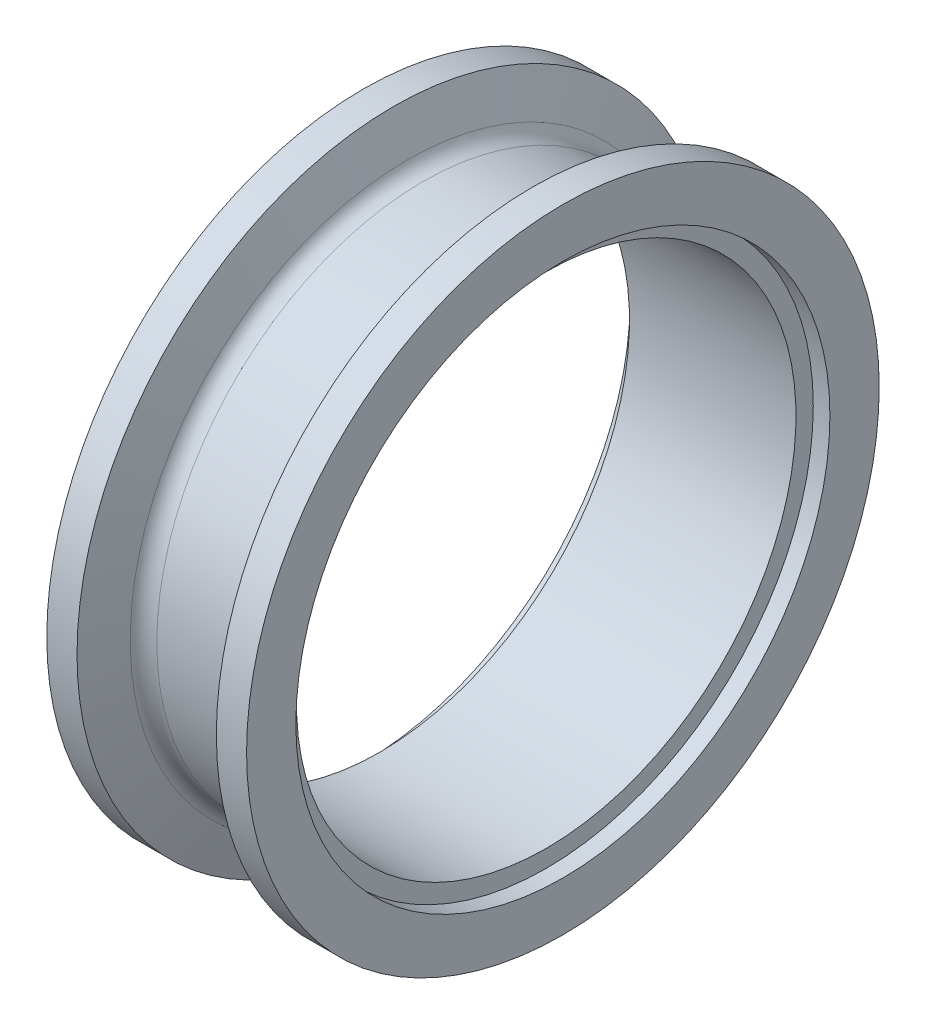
SolidWorks part; units mm, degrees
ref_plane "Front" through (0, 0, 0) normal (0, 0, 1) x (1, 0, 0)
ref_plane "Top" through (0, 0, 0) normal (0, 1, 0) x (1, 0, 0)
ref_plane "Right" through (0, 0, 0) normal (1, 0, 0) x (0, 0, -1)
sketch "Sketch1" plane through (0, 0, 0) normal (0, 0, 1) x (1, 0, 0)
  line L0 (19.05, 0) -> (0, 0) construction
  line L1 (0, 60.325) -> (0, -60.325) construction
  line L2 (0, 60.325) -> (5.7658, 60.325)
  line L3 (5.7658, 60.325) -> (8.4723, 52.8891)
  line L4 (3.175, 47.625) -> (34.925, 47.625)
  line L5 (11.4558, 50.8) -> (26.6442, 50.8)
  line L6 (3.175, 50.927) -> (0, 50.927)
  line L7 (19.05, 55.8345) -> (19.05, 31.4646) construction
  line L8 (34.925, 50.927) -> (34.925, 47.625)
  line L10 (38.1, 60.325) -> (38.1, 50.927)
  line L11 (34.925, 50.927) -> (38.1, 50.927)
  line L12 (0, 60.325) -> (0, 50.927)
  line L13 (32.3342, 60.325) -> (29.6277, 52.8891)
  line L14 (38.1, 60.325) -> (32.3342, 60.325)
  line L15 (3.175, 50.927) -> (3.175, 47.625)
  arc A0 (8.4723, 52.8891) -> (11.4558, 50.8) centre (11.4558, 53.975) ccw
  arc A2 (29.6277, 52.8891) -> (26.6442, 50.8) centre (26.6442, 53.975) cw
  point P20 (9.2326, 50.8)
  dimension "D7" = 3.175
  dimension "D10" = 3.175
  dimension "D2" = 3.175
  dimension "D3" = 38.1
  dimension "D4" = 101.6
  dimension "D5" = 3.175
  dimension "D6" = 101.854
  dimension "D8" = 5.7658
  dimension "D9" = 70
  dimension "D13" = 120.65
  dimension "D15" = 5.7658
  dimension "D16" = 70
revolve "Revolve1" add sketch "Sketch1" angle 360 about L0
